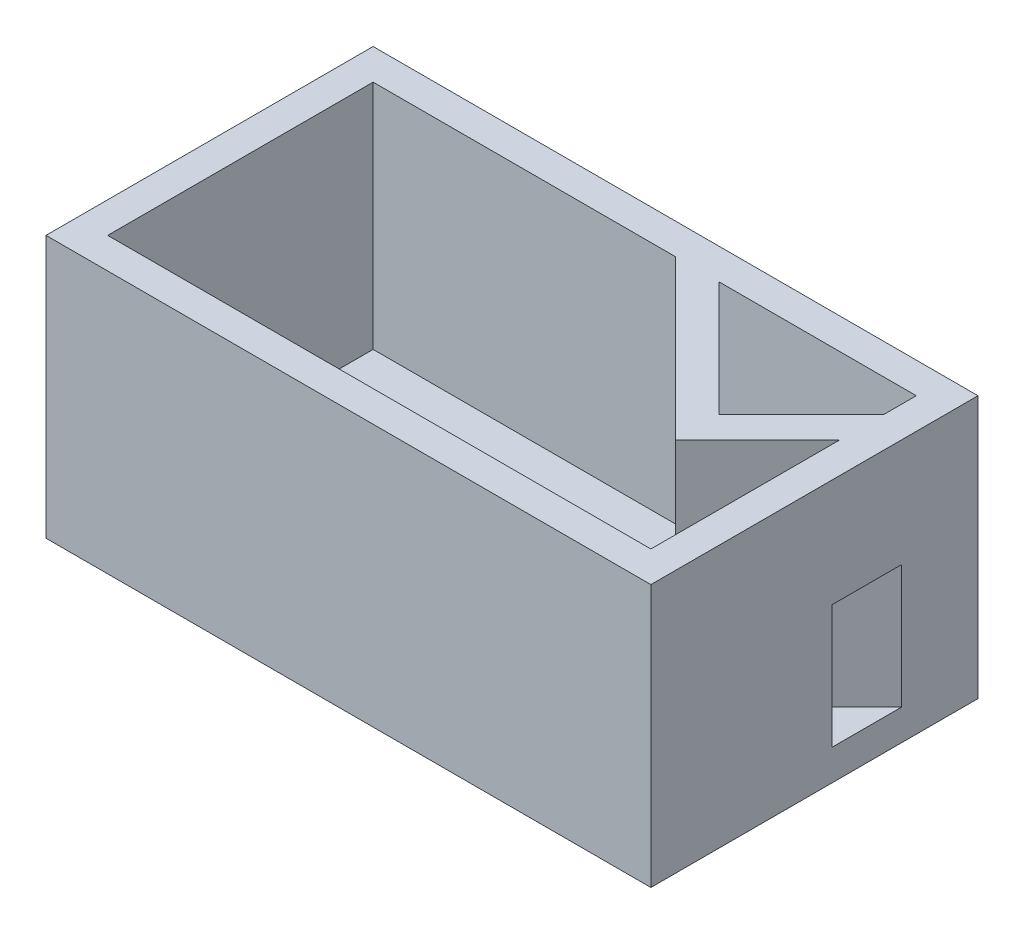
SolidWorks part; units mm, degrees
ref_plane "Front Plane" through (0, 0, 0) normal (0, 0, 1) x (1, 0, 0)
ref_plane "Top Plane" through (0, 0, 0) normal (0, 1, 0) x (1, 0, 0)
ref_plane "Right Plane" through (0, 0, 0) normal (1, 0, 0) x (0, 0, -1)
sketch "Sketch1" plane through (0, 0, 0) normal (0, 0, 1) x (1, 0, 0)
  line L1 (0, 0) -> (4978.4, 0)
  line L2 (0, 0) -> (0, 2159)
  line L3 (0, 2159) -> (4978.4, 2159)
  line L4 (4978.4, 0) -> (4978.4, 2159)
  dimension "D1" = 2159
  dimension "D2" = 4978.4
extrude "Boss-Extrude1" add sketch "Sketch1" along normal blind 2692.4
shell "Shell1" thickness 254
sketch "Sketch2" plane through (0, 2159, 0) normal (0, 1, 0) x (1, 0, 0)
  line L0 (2921, -254) -> (4047.1934, -1380.1934)
  line L1 (254, -254) -> (4724.4, -254) construction
  line L3 (4724.4, -2438.4) -> (4724.4, -254) construction
  line L4 (254, -2438.4) -> (254, -254) construction
  line L5 (4047.1934, -1380.1934) -> (4724.4, -702.9867)
  dimension "D1" = 1803.4
  dimension "D2" = 45
  dimension "D3" = 317.4816
rib "Rib1" sketch "Sketch2" sketch "Sketch2" thickness 254 extrusion direction normal to sketch draft on no parameters "D1"=254
ref_plane "Plane2" through (4047.1934, 2159, 1559.7985) normal (0.7071, 0, -0.7071) x (-0.7071, 0, -0.7071)
sketch "Sketch3" plane through (4047.1934, 2159, 1559.7985) normal (0.7071, 0, -0.7071) x (-0.7071, 0, -0.7071)
  line L2 (0, -1905) -> (0, -889)
  line L3 (-406.4, -1905) -> (0, -1905)
  line L4 (0, -889) -> (-406.4, -889)
  line L5 (-406.4, -889) -> (-406.4, -1905)
  dimension "D1" = 406.4
  dimension "D2" = 1016
extrude "Cut-Extrude1" cut sketch "Sketch3" along normal through all
